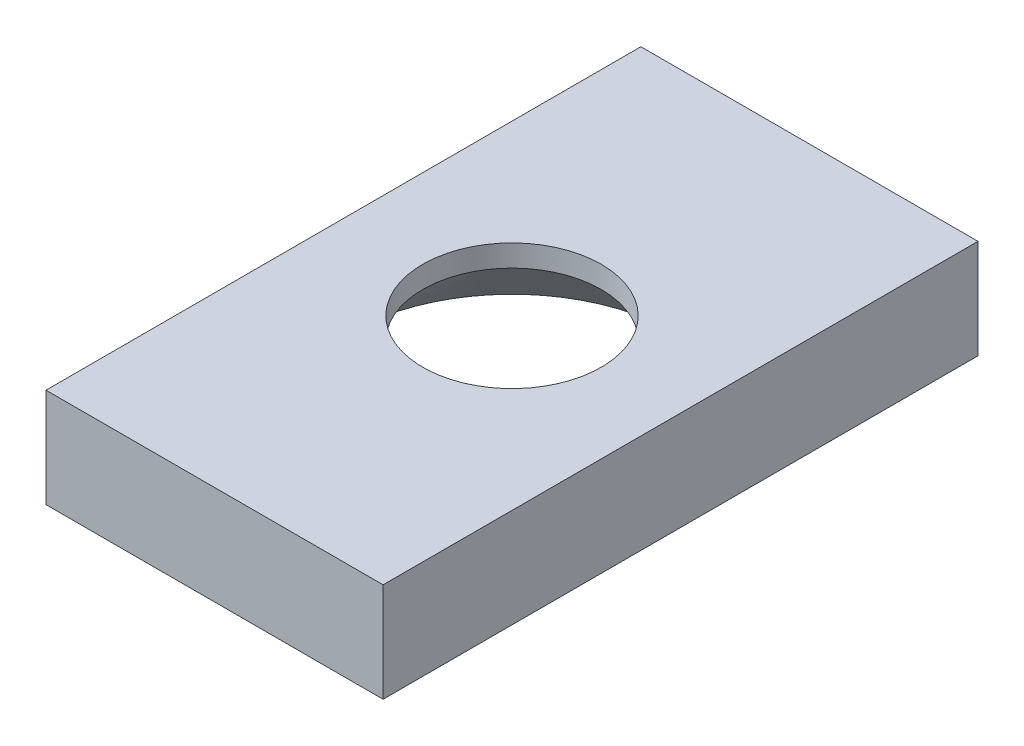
SolidWorks part; units mm, degrees
ref_plane "Face" through (0, 0, 0) normal (0, 0, 1) x (1, 0, 0)
ref_plane "Dessus" through (0, 0, 0) normal (0, 1, 0) x (1, 0, 0)
ref_plane "Droite" through (0, 0, 0) normal (1, 0, 0) x (0, 0, -1)
sketch "Esquisse1" plane through (0, 0, 0) normal (0, 0, 1) x (1, 0, 0)
  line L1 (-8.5, -2.5) -> (8.5, -2.5)
  line L2 (-8.5, -2.5) -> (-8.5, 2.5)
  line L3 (-8.5, 2.5) -> (8.5, 2.5)
  line L4 (8.5, -2.5) -> (8.5, 2.5)
  dimension "D1" = 17
  dimension "D2" = 5
  dimension "D3" = 2.5
  dimension "D4" = 8.5
extrude "Extrusion1" add sketch "Esquisse1" along normal blind 30
hole_wizard "Fraisage pour vis à tête fraisée à 6 pans creux M81" positions "Esquisse5" profile "Esquisse4" countersink size "M8" standard "ISO"
sketch "Esquisse5" plane through (0, -2.5, 0) normal (0, -1, 0) x (1, 0, 0)
  line L0 (-8.5, 0) -> (8.5, 0) construction
  line L1 (0, -2.5199) -> (0, 31.5629) construction
  point P0 (0, 15)
  dimension "D1" = 15
sketch "Esquisse4" plane through (0, -2.5, 15) normal (1, 0, 0) x (0, 0, -1)
  line L0 (0, 0) -> (0, 12.7039)
  line L1 (0, 12.7039) -> (4.5, 10)
  line L2 (4.5, 10) -> (4.5, 3.9)
  line L3 (4.5, 3.9) -> (8.4, 0)
  line L5 (8.4, 0) -> (0, 0)
  line L6 (-4.5, 3.9) -> (-8.4, 0) construction
  line L10 (0, 12.7039) -> (-4.5, 10) construction
  line L11 (0, -6.35) -> (0, 107.95) construction
  dimension "Diamètre du perçage" = 9
  dimension "Profondeur du perçage" = 10
  dimension "Diamètre du fraisage entrant" = 16.8
  dimension "Angle du fraisage entrant" = 90
  dimension "Angle de pointe" = 118
